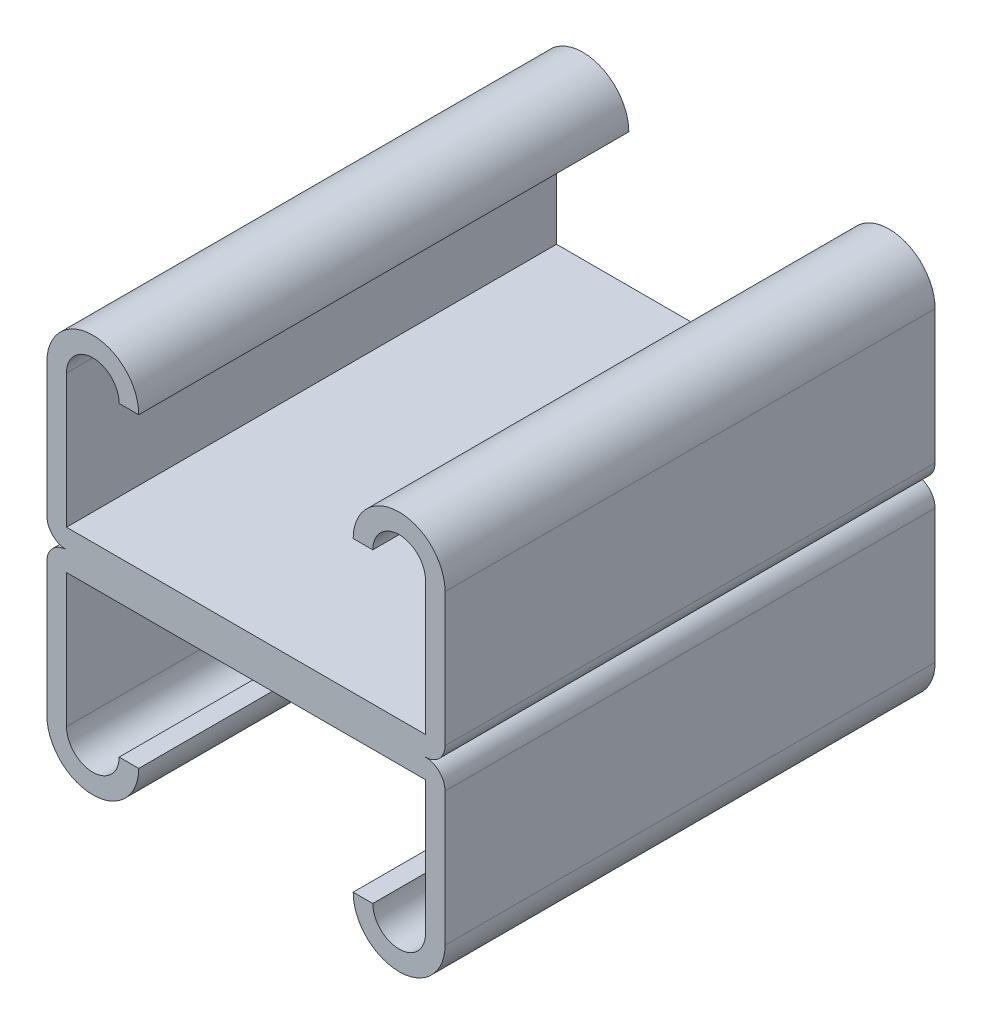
SolidWorks part; units mm, degrees
ref_plane "Plane1" through (0, 0, 0) normal (0, 0, 1) x (1, 0, 0)
ref_plane "Plane2" through (0, 0, 0) normal (0, 1, 0) x (1, 0, 0)
ref_plane "Plane3" through (0, 0, 0) normal (1, 0, 0) x (0, 0, -1)
sketch "Sketch1" plane through (0, 0, 0) normal (0, 0, 1) x (1, 0, 0)
  line L0 (-10.3188, 7.9375) -> (-10.3188, 1.016)
  line L1 (-9.3028, 0) -> (9.3028, 0)
  line L2 (10.3188, 1.016) -> (10.3187, 7.9375)
  line L3 (-6.5723, 7.9375) -> (-5.5563, 7.9375)
  line L4 (5.5562, 7.9375) -> (6.5722, 7.9375)
  line L6 (-9.3028, 7.9375) -> (-9.3028, 1.016)
  line L7 (-9.3028, 1.016) -> (9.3028, 1.016)
  line L8 (9.3028, 1.016) -> (9.3027, 7.9375)
  line L10 (-25.4, 10.3187) -> (25.4, 10.3187) construction
  arc A0 (10.3187, 7.9375) -> (5.5562, 7.9375) centre (7.9375, 7.9375) ccw
  arc A1 (-10.3188, 7.9375) -> (-5.5563, 7.9375) centre (-7.9375, 7.9375) cw
  arc A2 (-9.3028, 0) -> (-10.3188, 1.016) centre (-9.3028, 1.016) cw
  arc A3 (9.3028, 0) -> (10.3188, 1.016) centre (9.3028, 1.016) ccw
  arc A4 (-9.3028, 7.9375) -> (-6.5723, 7.9375) centre (-7.9375, 7.9375) cw
  arc A5 (9.3027, 7.9375) -> (6.5722, 7.9375) centre (7.9375, 7.9375) ccw
  dimension "D1" = 1.016
  dimension "D3" = 4.7625
  dimension "D4" = 11.1125
  dimension "Width" = 20.6375
  dimension "D5" = 1.016
  dimension "D6" = 4.7625
  dimension "D2" = 10.3187
  dimension "gauge" = 1.016
extrude "Base-Extrude" add sketch "Sketch1" along normal mid plane 25.4
mirror "Mirror1" about plane through (0, 0, 0) normal (0, 1, 0) of "Base-Extrude"
equation "\"D1@Sketch1\" = \"gauge@Sketch1\""
